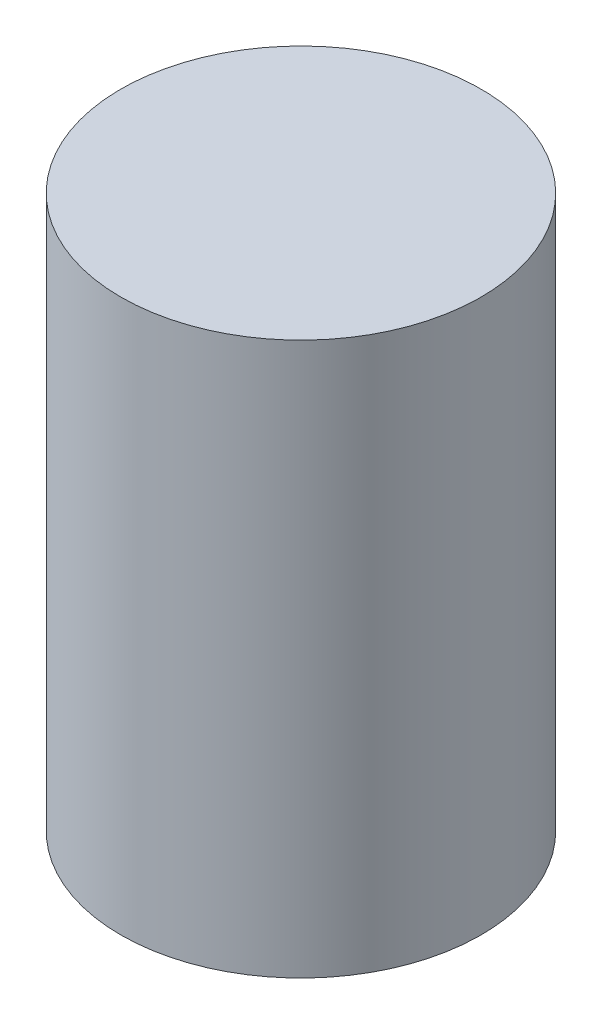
SolidWorks part; units mm, degrees
ref_plane "Front Plane" through (0, 0, 0) normal (0, 0, 1) x (1, 0, 0)
ref_plane "Top Plane" through (0, 0, 0) normal (0, 1, 0) x (1, 0, 0)
ref_plane "Right Plane" through (0, 0, 0) normal (1, 0, 0) x (0, 0, -1)
sketch "Sketch1" plane through (0, 0, 0) normal (0, 1, 0) x (1, 0, 0)
  circle A0 centre (0, 0) radius 3.75
  dimension "D1" = 7.5
extrude "Boss-Extrude1" add sketch "Sketch1" along normal blind 11.5
